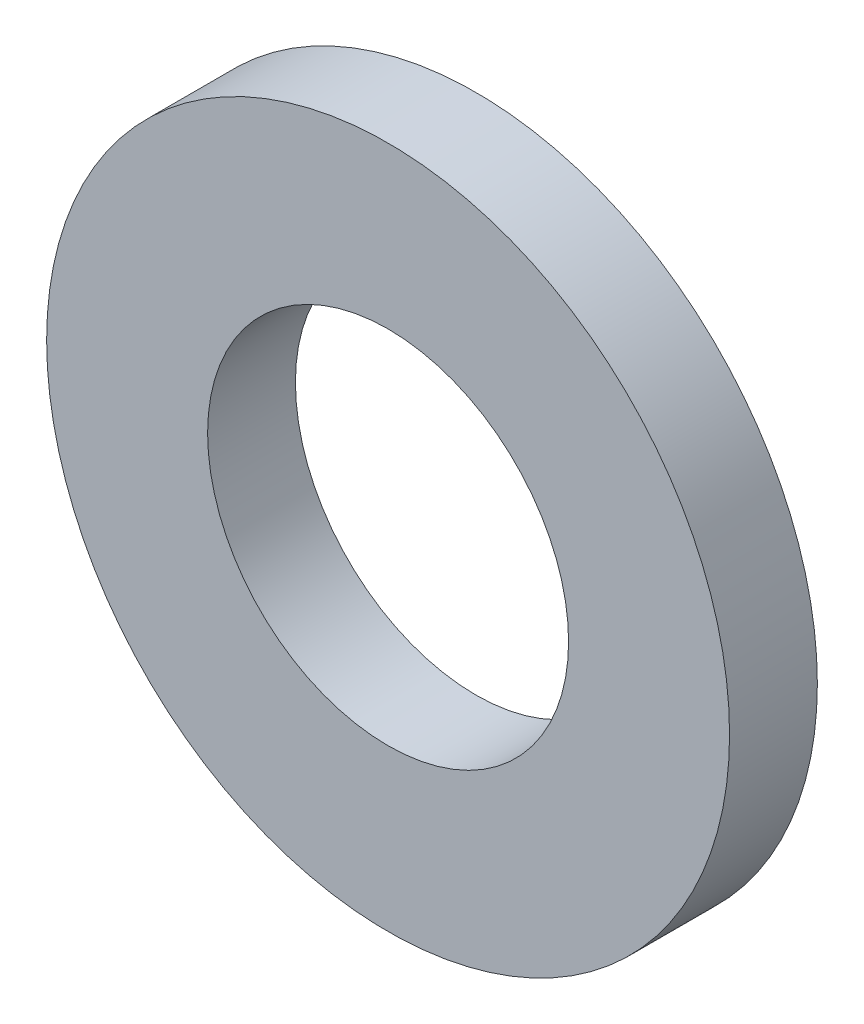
SolidWorks part; units mm, degrees
ref_plane "Front Plane" through (0, 0, 0) normal (0, 0, 1) x (1, 0, 0)
ref_plane "Top Plane" through (0, 0, 0) normal (0, 1, 0) x (1, 0, 0)
ref_plane "Right Plane" through (0, 0, 0) normal (1, 0, 0) x (0, 0, -1)
sketch "Sketch1" plane through (0, 0, 0) normal (0, 0, 1) x (1, 0, 0)
  circle A0 centre (0, 0) radius 7
  circle A1 centre (0, 0) radius 3.7
  dimension "OD" = 14
  dimension "ID1" = 7.4
extrude "Boss-Extrude1" add sketch "Sketch1" along normal blind 1.8
